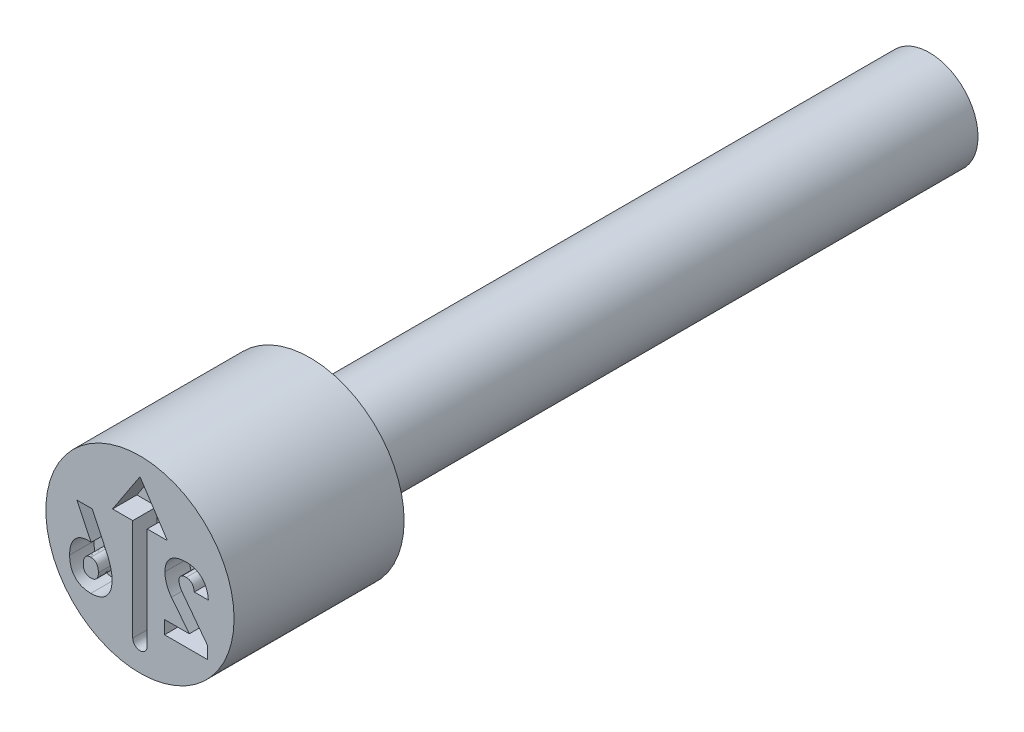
SolidWorks part; units mm, degrees
ref_plane "Front Plane" through (0, 0, 0) normal (0, 0, 1) x (1, 0, 0)
ref_plane "Top Plane" through (0, 0, 0) normal (0, 1, 0) x (1, 0, 0)
ref_plane "Right Plane" through (0, 0, 0) normal (1, 0, 0) x (0, 0, -1)
sketch "Sketch2" plane through (0, 0, 0) normal (1, 0, 0) x (0, 0, -1)
  line L0 (0.4039, 0) -> (50000.4039, 0) construction
  line L6 (0, 1.55) -> (0, 0)
  line L7 (2.8, 1.55) -> (0, 1.55)
  line L8 (2.8, 0.8) -> (2.8, 1.55)
  line L9 (13, 0.8) -> (2.8, 0.8)
  line L10 (13, 0) -> (13, 0.8)
  line L11 (0, 0) -> (13, 0)
  dimension "D1" = 3.1
  dimension "D2" = 1.6
  dimension "D3" = 13
  dimension "D4" = 2.8
revolve "Revolve1" add sketch "Sketch2" angle 360 about L0
sketch "Sketch3" plane through (0, 0, 0) normal (0, 0, 1) x (1, 0, 0)
  line L0 (0, 0) -> (0, 62500) construction
  line L1 (0.119, 0.5665) -> (0.119, -1.1101)
  line L2 (0.4512, 0.5665) -> (0.119, 0.5665)
  line L3 (0, 1.2513) -> (0.4512, 0.5665)
  line L15 (0, 1.2513) -> (-0.4512, 0.5665)
  line L16 (-0.4512, 0.5665) -> (-0.119, 0.5665)
  line L17 (-0.119, 0.5665) -> (-0.119, -1.1101)
  arc A2 (-0.119, -1.1101) -> (0.119, -1.1101) centre (0, -1.1101) ccw
extrude "Cut-Extrude4" cut sketch "Sketch3" against normal blind 0.4
sketch "Sketch4" plane through (0, 0, 0) normal (0, 0, 1) x (1, 0, 0)
  text T0 "2  6" font "Bahnschrift" height 1.2
  dimension "D1" = 0.8
  dimension "D2" = 1.2
extrude "Cut-Extrude5" cut sketch "Sketch4" against normal blind 0.4
